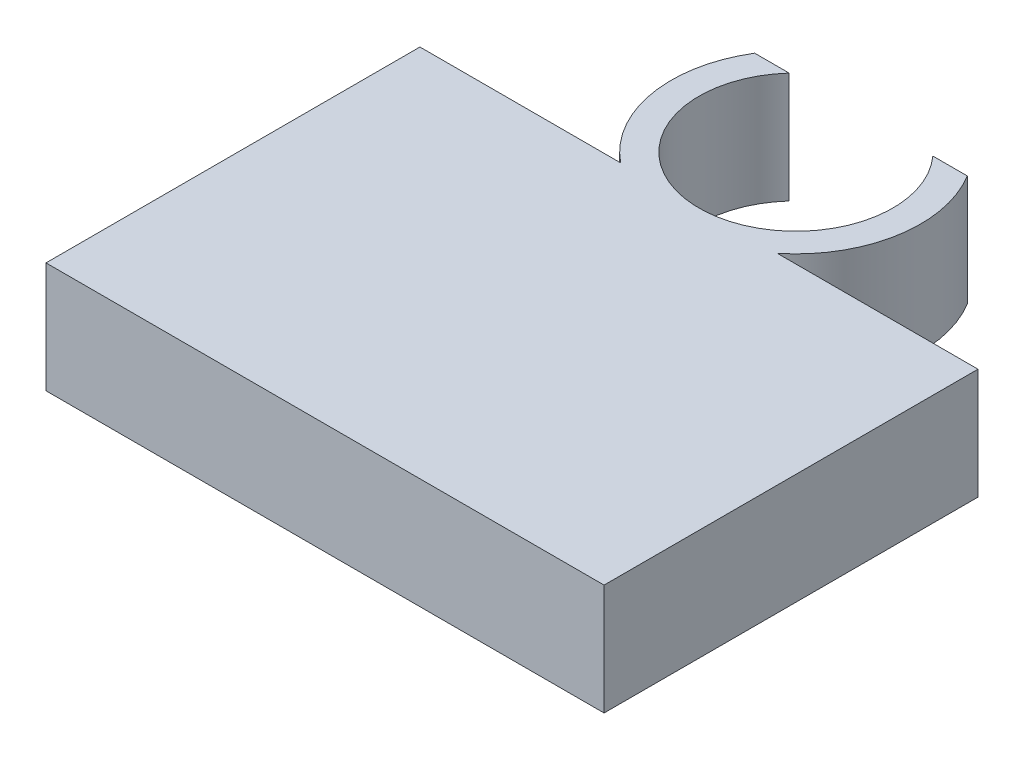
SolidWorks part; units mm, degrees
ref_plane "前视基准面" through (0, 0, 0) normal (0, 0, 1) x (1, 0, 0)
ref_plane "上视基准面" through (0, 0, 0) normal (0, 1, 0) x (1, 0, 0)
ref_plane "右视基准面" through (0, 0, 0) normal (1, 0, 0) x (0, 0, -1)
other "Configuration Table"
sketch "草图1" plane through (0, 0, 0) normal (0, 1, 0) x (1, 0, 0)
  circle A0 centre (0, 0) radius 1.75
  circle A1 centre (0, 0) radius 2.25
extrude "凸台-拉伸1" add sketch "草图1" along normal blind 2
sketch "草图2" plane through (0, 2, 0) normal (0, 1, 0) x (1, 0, 0)
  line L0 (0, -2.25) -> (0, -2.75)
  line L2 (-5.037, -1.75) -> (5.037, -1.75)
  line L3 (-5.037, -1.75) -> (-5.037, -2.75)
  line L4 (-5.037, -2.75) -> (5.037, -2.75)
  line L5 (5.037, -1.75) -> (5.037, -2.75)
  line L6 (-5.037, -1.75) -> (5.037, -2.75) construction
  line L7 (-5.037, -2.75) -> (5.037, -1.75) construction
  circle A0 centre (0, 0) radius 2.25 construction
extrude "凸台-拉伸2" add sketch "草图2" against normal blind 2 contours L5 L2 L0 L4 M2 | L3 L4 L0 L2 M2
sketch "草图4" plane through (0, 0, 0) normal (0, -1, 0) x (1, 0, 0)
  line L1 (5.0137, -2.25) -> (-4.7868, -2.25)
  line L2 (5.0137, -2.25) -> (5.0137, -1.2682)
  line L3 (5.0137, -1.2682) -> (-4.7868, -1.2682)
  line L4 (-4.7868, -2.25) -> (-4.7868, -1.2682)
extrude "切除-拉伸1" cut sketch "草图4" against normal blind 2
sketch "草图5" plane through (0, 0, 0) normal (0, -1, 0) x (1, 0, 0)
  line L5 (-4.7976, -0.7881) -> (5.0786, -0.7881)
  line L6 (-4.7976, -0.7881) -> (-4.7976, -1.404)
  line L7 (-4.7976, -1.404) -> (5.0786, -1.404)
  line L8 (5.0786, -0.7881) -> (5.0786, -1.404)
extrude "切除-拉伸2" cut sketch "草图5" against normal blind 2
sketch "草图6" plane through (0, 0, 0) normal (0, -1, 0) x (1, 0, 0)
  line L1 (-2.25, -1.1747) -> (2.25, -1.1747)
  line L2 (-2.25, -1.1747) -> (-2.25, -2.25)
  line L3 (-2.25, -2.25) -> (2.25, -2.25)
  line L4 (2.25, -1.1747) -> (2.25, -2.25)
  circle A0 centre (0, 0) radius 1.75
  circle A1 centre (0, 0) radius 2.25
extrude "凸台-拉伸3" add sketch "草图6" against normal blind 2 contours A1 L1 A0 M6 | L1 A1 A0 M8
sketch "草图7" plane through (0, 2, 0) normal (0, 1, 0) x (1, 0, 0)
  line L0 (30.1565, -8.5) -> (-29.8435, -8.5) construction
  line L1 (-5.037, -2.75) -> (5.037, -2.75)
  line L2 (-5.037, -2.75) -> (-5.037, -8.5)
  line L3 (-5.037, -8.5) -> (5.037, -8.5)
  line L4 (5.037, -2.75) -> (5.037, -8.5)
extrude "凸台-拉伸4" add sketch "草图7" against normal blind 2
